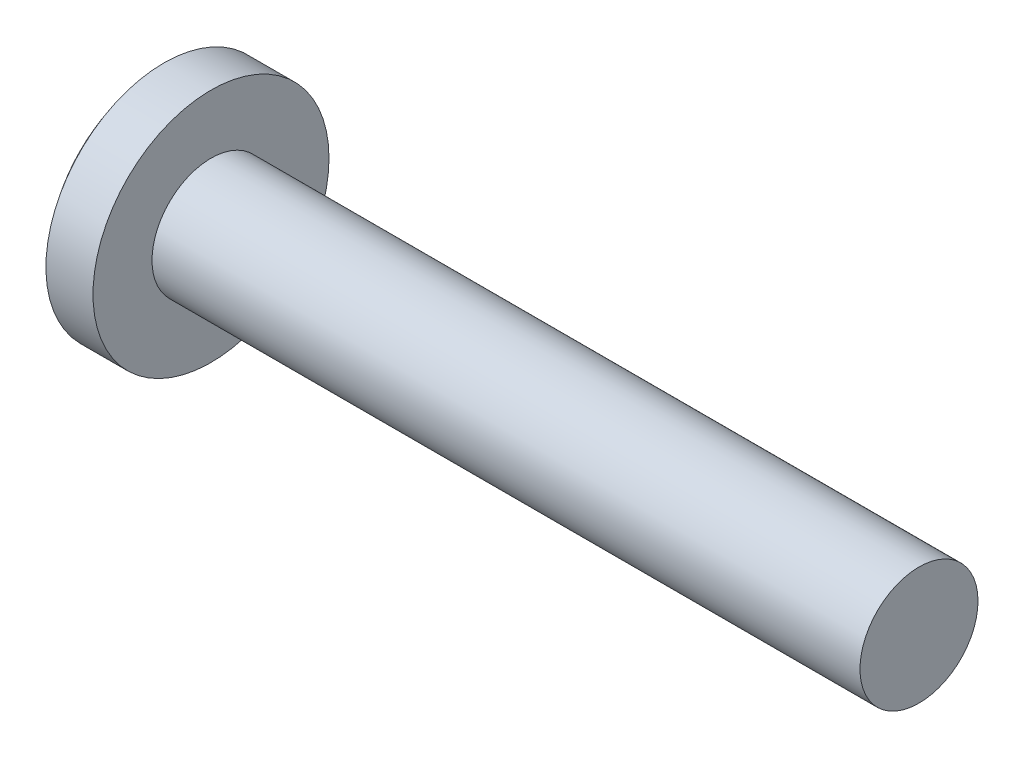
SolidWorks part; units mm, degrees
ref_plane "Front" through (0, 0, 0) normal (0, 0, 1) x (1, 0, 0)
ref_plane "Top" through (0, 0, 0) normal (0, 1, 0) x (1, 0, 0)
ref_plane "Right" through (0, 0, 0) normal (1, 0, 0) x (0, 0, -1)
sketch "Sketch1" plane through (0, 0, 0) normal (0, 0, 1) x (1, 0, 0)
  line L0 (67.5, 5) -> (10.5, 5)
  line L1 (7.5, 5.6) -> (7.5, 10)
  line L2 (7.5, 10) -> (3.51, 10)
  line L3 (10.5, 5) -> (7.7671, 5.3018) construction
  line L4 (67.5, 5) -> (67.5, 0)
  line L5 (4.5158, 0) -> (-13.5157, 0) construction
  line L6 (67.5, 0) -> (0, 0)
  line L7 (10.5, 5) -> (7.5, 5)
  line L8 (7.5, 5) -> (7.5, 5.6)
  arc A0 (3.51, 10) -> (0, 0) centre (16, 0) ccw
  arc A1 (7.5, 5.6) -> (7.7671, 5.3018) centre (7.8, 5.6) ccw construction
  dimension "r" = 0.3
  dimension "r1" = 16
  dimension "dk" = 20
  dimension "l" = 60
  dimension "k" = 7.5
  dimension "a" = 3
  dimension "da" = 11.2
revolve "Base" add sketch "Sketch1" angle 360 about L5
sketch "Sketch6" plane through (0, 0, 0) normal (1, 0, 0) x (0, 0, -1)
  line L0 (-1.9271, 0) -> (2.0512, 0) construction
  line L1 (0, 1.8651) -> (0, -2.0207) construction
  line L2 (1.01, 1.01) -> (1.01, 5.05)
  line L3 (1.01, 5.05) -> (-1.01, 5.05)
  line L4 (-1.01, 1.01) -> (-1.01, 5.05)
  line L5 (1.01, 1.01) -> (5.05, 1.01)
  line L6 (5.05, 1.01) -> (5.05, -1.01)
  line L7 (-5.05, 1.01) -> (-5.05, -1.01)
  line L8 (-1.01, 1.01) -> (-5.05, 1.01)
  line L9 (-1.01, -1.01) -> (-5.05, -1.01)
  line L10 (1.01, -1.01) -> (5.05, -1.01)
  line L11 (-1.01, -1.01) -> (-1.01, -5.05)
  line L12 (1.01, -5.05) -> (-1.01, -5.05)
  line L13 (1.01, -1.01) -> (1.01, -5.05)
  point P16 (-5.05, 0)
  point P17 (5.05, 0)
extrude "CrossRecess" cut sketch "Sketch6" along normal blind 5.25
fillet "Fillet5" radius 0.3 4 edges at (2.6569, -1.01, 1.01) (2.6569, -1.01, -1.01) (2.6569, 1.01, 1.01) (2.6569, 1.01, -1.01)
draft "Draft1" type of draft neutral plane draft angle 30 neutral plane "Right" faces to draft 4 parameters "D1"=30
sketch "Sketch7" plane through (0, 0, 0) normal (1, 0, 0) x (0, 0, -1)
  line L0 (-2.0126, 0) -> (1.9757, 0) construction
  line L1 (0, 1.9314) -> (0, -2.0126) construction
  line L2 (0, 0) -> (1.5555, 1.5555) construction
  line L3 (0, 1.5092) -> (3.5709, 3.5709)
  line L4 (-1.5402, 1.5402) -> (0, 0) construction
  line L5 (1.5092, 0) -> (3.5709, 3.5709)
  line L6 (0, -1.5092) -> (3.5709, -3.5709)
  line L7 (1.5092, 0) -> (3.5709, -3.5709)
  line L8 (-1.5092, 0) -> (-3.5709, -3.5709)
  line L9 (0, -1.5092) -> (-3.5709, -3.5709)
  line L10 (-1.5092, 0) -> (-3.5709, 3.5709)
  line L11 (0, 1.5092) -> (-3.5709, 3.5709)
  dimension "D3" = 15
extrude "Cut-Extrude3" [suppressed] cut sketch "Sketch7" along normal blind 40.2 draft 9
sketch "Sketch8" plane through (0, 0, 0) normal (0, 0, 1) x (1, 0, 0)
  line L0 (29.5, 5) -> (25.7, 4.188)
  line L1 (25.7, 4.188) -> (7.5, 4.188)
  line L2 (67.5, -5) -> (67.5, 5) construction
  line L3 (7.5, -10) -> (7.5, 10) construction
  line L6 (7.5, 4.188) -> (7.5, 10)
  line L7 (7.5, 10) -> (29.5, 10)
  line L8 (29.5, 10) -> (29.5, 5)
  line L9 (73.4853, 0) -> (63.9694, 0) construction
  dimension "x" = 3.8
sketch "Sketch9" plane through (0, 0, 0) normal (0, 0, 1) x (1, 0, 0)
  line L0 (67.5, 4.2968) -> (67.906, 5)
  line L1 (67.906, 5) -> (67.906, 5.812)
  line L2 (67.906, 5.812) -> (67.094, 5.812)
  line L3 (67.094, 5.812) -> (67.094, 5)
  line L4 (67.094, 5) -> (67.5, 4.2968)
  line L5 (67.5, -5) -> (67.5, 5) construction
  line L6 (0, 0) -> (76.7811, 0) construction
  dimension "D1" = 10
  dimension "D2" = 0.812
revolve "Cut-Revolve10" [suppressed] cut sketch "Sketch9" angle 360 about L6
pattern_linear "LPattern10" [suppressed] count 58 spacing 0.9744 along (1, 0, 0)
equation "\"D1@Sketch6\" = \"m@Sketch6\" / 5"
equation "\"D1@CrossRecess\" = 0.7*\"k@Sketch1\""
equation "\"D1@Sketch9\" = \"d@Sketch1\" "
equation "\"D2@Sketch9\" =  ( \"d@Sketch1\" - \"THD_MINOR@ThreadCosmetic1\" )  / 2"
equation "\"D3@LPattern10\" =\"D2@Sketch9\" * 1.2"
equation "\"D1@LPattern10\" = \"bb@ThreadCosmetic1\" / \"D3@LPattern10\" "
